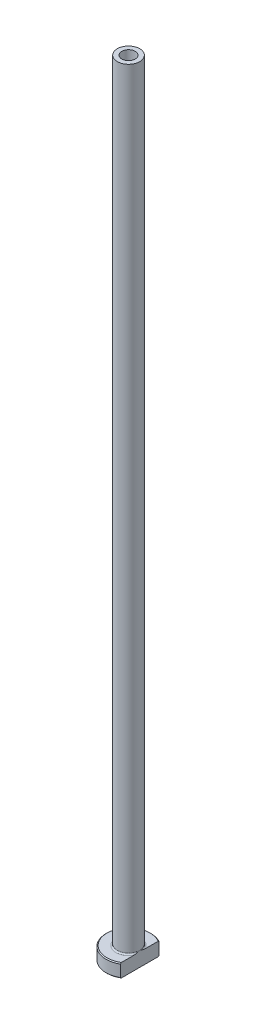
SolidWorks part; units mm, degrees
ref_plane "Front Plane" through (0, 0, 0) normal (0, 0, 1) x (1, 0, 0)
ref_plane "Top Plane" through (0, 0, 0) normal (0, 1, 0) x (1, 0, 0)
ref_plane "Right Plane" through (0, 0, 0) normal (1, 0, 0) x (0, 0, -1)
sketch "Sketch1" plane through (0, 0, 0) normal (0, 0, 1) x (1, 0, 0)
  line L0 (-1.5, 175) -> (-2.5, 175)
  line L1 (-2.5, 175) -> (-2.5, 3)
  line L2 (-2.5, 3) -> (-5, 3)
  line L3 (-5, 3) -> (-5, 0)
  line L4 (4.125, 0) -> (-4.125, 0) construction
  line L5 (-5, 0) -> (-1.75, 0)
  line L6 (-1.5, 130) -> (-1.5, 175)
  line L7 (0, 92.1877) -> (0, -15.5353) construction
  line L8 (0, -5.5) -> (0, 5.5) construction
  line L9 (-1.5, 130) -> (-1.75, 118)
  line L10 (-1.75, 118) -> (-1.75, 0)
  dimension "D1" = 0.25
  dimension "ID" = 3
  dimension "OD" = 5
  dimension "L" = 175
  dimension "H" = 10
  dimension "T" = 3
  dimension "N" = 45
  dimension "D2" = 12
  dimension "L-N" = 130
revolve "Revolve1" add sketch "Sketch1" angle 360 about L7
fillet "Fillet1" radius 0.3 1 edges at (0, 3, 2.5)
chamfer "Chamfer1" distance 0.2 angle 45 2 edges at (0, 3, 5) (0, 0, 5)
sketch "Sketch2" plane through (0, 0, 0) normal (0, -1, 0) x (1, 0, 0)
  line L0 (2.5, 4.3301) -> (2.5, -4.3301)
  circle A0 centre (0, 0) radius 5 construction
  arc A1 (2.5, 4.3301) -> (2.5, -4.3301) centre (0, 0) cw
  circle A2 centre (0, 0) radius 2.5 construction
extrude "Cut-Extrude1" cut sketch "Sketch2" against normal through all
chamfer "Chamfer2" distance 0.5 angle 45 1 edges at (0, 0, 1.75)
